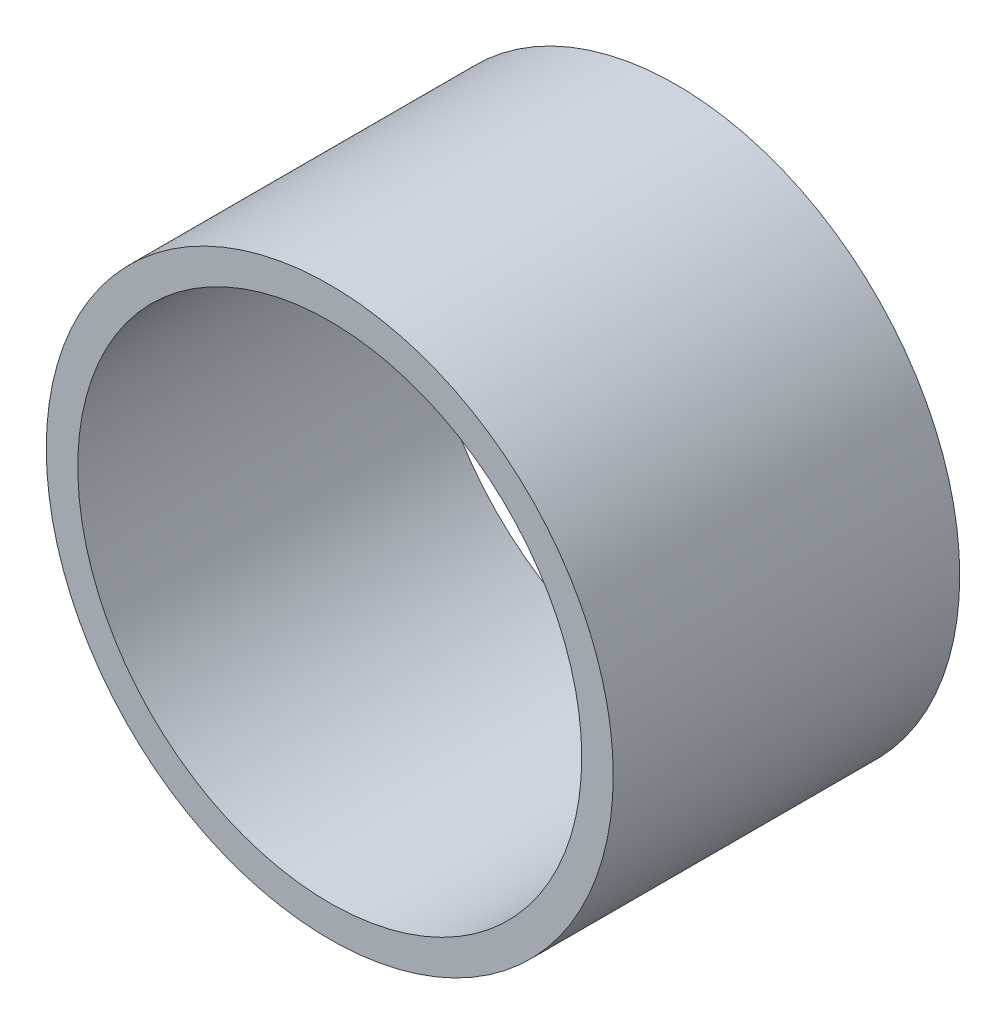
SolidWorks part; units mm, degrees
ref_plane "Plan1" through (0, 0, 0) normal (0, 0, 1) x (1, 0, 0)
ref_plane "Plan2" through (0, 0, 0) normal (0, 1, 0) x (1, 0, 0)
ref_plane "Plan3" through (0, 0, 0) normal (1, 0, 0) x (0, 0, -1)
sketch "Esquisse1" plane through (0, 0, 0) normal (0, 0, 1) x (1, 0, 0)
  circle A0 centre (0, 0) radius 18
  circle A1 centre (0, 0) radius 16
  dimension "D1" = 32
  dimension "D2" = 36
extrude "Base-Extrusion" add sketch "Esquisse1" along normal blind 22
